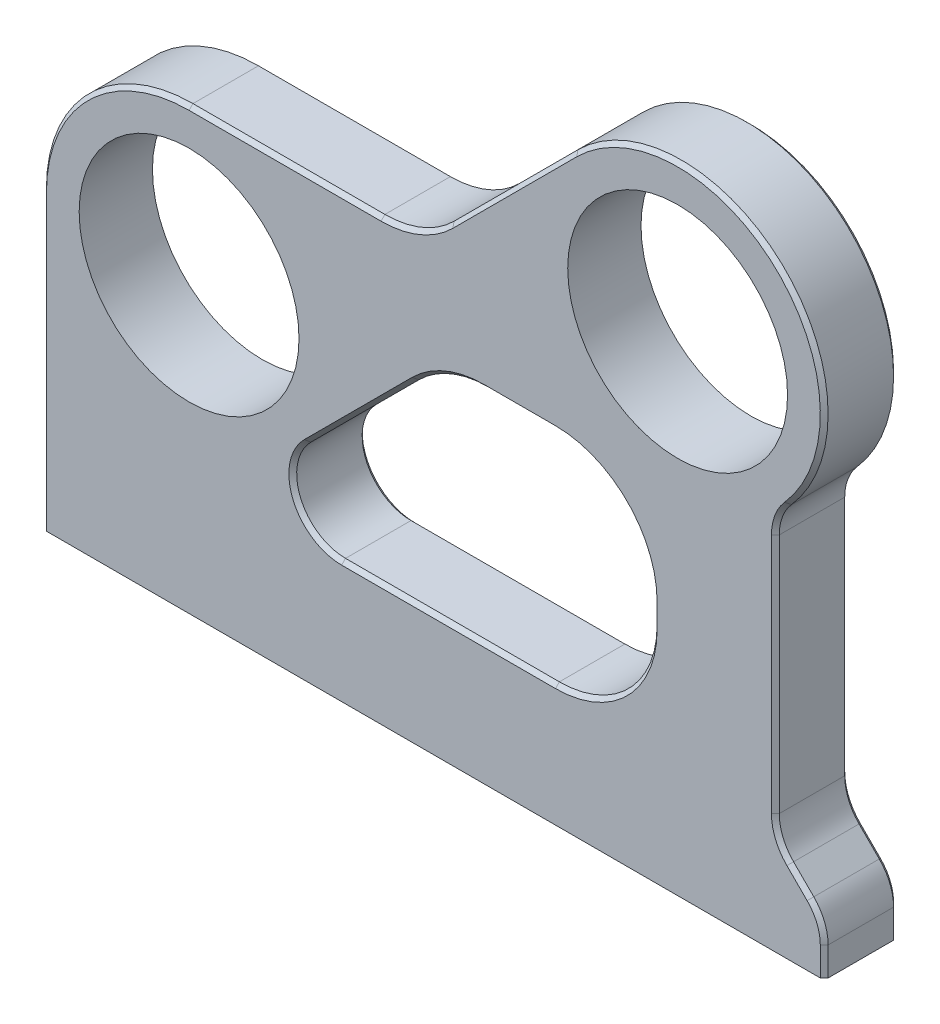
SolidWorks part; units mm, degrees
ref_plane "Front Plane" through (0, 0, 0) normal (0, 0, 1) x (1, 0, 0)
ref_plane "Top Plane" through (0, 0, 0) normal (0, 1, 0) x (1, 0, 0)
ref_plane "Right Plane" through (0, 0, 0) normal (1, 0, 0) x (0, 0, -1)
sketch "Sketch1" plane through (0, 0, 0) normal (0, 0, 1) x (1, 0, 0)
  line L0 (0, 19.05) -> (24.9487, 19.05)
  line L1 (29.3529, 2.6303) -> (15.3377, -11.3849)
  line L2 (-19.05, 0) -> (-19.05, -38.1)
  line L3 (-19.05, -38.1) -> (82.55, -38.1)
  line L5 (50.0296, 38.8704) -> (33.929, 22.7697)
  line L6 (47.625, 6.35) -> (38.3331, 6.35)
  line L7 (76.2, 8.5995) -> (76.2, -22.7697)
  line L8 (60.325, -6.35) -> (60.325, -9.525)
  line L10 (19.8279, -22.225) -> (47.625, -22.225)
  line L11 (78.0599, -27.2599) -> (80.6901, -29.8901)
  line L12 (82.55, -34.3803) -> (82.55, -38.1)
  circle A0 centre (0, 0) radius 14.2875
  arc A1 (77.7875, 12.7996) -> (50.0296, 38.8704) centre (63.5, 25.4) ccw
  circle A2 centre (63.5, 25.4) radius 14.2875
  arc A3 (0, 19.05) -> (-19.05, 0) centre (0, 0) ccw
  arc A4 (15.3377, -11.3849) -> (19.8279, -22.225) centre (19.8279, -15.875) ccw
  arc A5 (24.9487, 19.05) -> (33.929, 22.7697) centre (24.9487, 31.75) ccw
  arc A6 (38.3331, 6.35) -> (29.3529, 2.6303) centre (38.3331, -6.35) ccw
  arc A7 (47.625, 6.35) -> (60.325, -6.35) centre (47.625, -6.35) cw
  arc A8 (60.325, -9.525) -> (47.625, -22.225) centre (47.625, -9.525) cw
  arc A9 (76.2, 8.5995) -> (77.7875, 12.7996) centre (82.55, 8.5995) cw
  arc A10 (76.2, -22.7697) -> (78.0599, -27.2599) centre (82.55, -22.7697) ccw
  arc A11 (80.6901, -29.8901) -> (82.55, -34.3803) centre (76.2, -34.3803) cw
  point P34 (82.55, -31.75)
  dimension "D1" = 28.575
  dimension "D2" = 25.4
  dimension "D9" = 28.575
  dimension "D8" = 38.1
  dimension "D4" = 19.05
  dimension "D12" = 12.7
  dimension "D14" = 12.7
  dimension "D16" = 25.4
  dimension "D11" = 12.7
  dimension "D17" = 12.7
  dimension "D21" = 6.35
  dimension "D22" = 6.35
  dimension "D3" = 101.6
  dimension "D5" = 19.05
  dimension "D6" = 38.1
  dimension "D7" = 63.5
  dimension "D10" = 45
  dimension "D13" = 6.35
  dimension "D15" = 15.875
  dimension "D18" = 15.875
  dimension "D19" = 45
  dimension "D20" = 6.35
extrude "Extrude1" add sketch "Sketch1" along normal mid plane 9.525
hole_wizard "#8-32 Tapped Hole1" positions "Sketch3" profile "Sketch2" tap size "#8-32" standard "Ansi Inch"
sketch "Sketch3" plane through (0, -38.1, 0) normal (0, -1, 0) x (1, 0, 0)
  point P0 (63.5, 0)
  point P1 (-12.7, 0)
  dimension "D1" = 76.2
  dimension "D2" = 12.7
sketch "Sketch2" plane through (63.5, -38.1, 0) normal (1, 0, 0) x (0, 0, -1)
  line L0 (0, 0) -> (0, 21.2054)
  line L1 (0, 21.2054) -> (1.7272, 20.1676)
  line L2 (1.7272, 20.1676) -> (1.7272, 17.78)
  line L3 (1.7272, 17.78) -> (2.0828, 17.78)
  line L4 (2.0828, 17.78) -> (2.0828, 0)
  line L5 (2.0828, 0) -> (0, 0)
  line L10 (0, 21.2054) -> (-1.7272, 20.1676) construction
  line L11 (0, -6.35) -> (0, 107.95) construction
  dimension "Tap Drill Dia." = 3.4544
  dimension "Tap Drill Depth" = 20.1676
  dimension "Thread Major Dia." = 4.1656
  dimension "Thread Depth" = 17.78
  dimension "Drill Angle" = 118
sketch "Sketch4" plane through (0, -38.1, 0) normal (0, -1, 0) x (1, 0, 0)
  circle A0 centre (0, 0) radius 2.3813
  circle A1 centre (50.8, 0) radius 2.3812
  circle A2 centre (-12.7, 0) radius 2.0828 construction
  circle A3 centre (63.5, 0) radius 2.0828 construction
  dimension "D1" = 4.7625
  dimension "D2" = 12.7
  dimension "D3" = 12.7
extrude "Cut-Extrude1" cut sketch "Sketch4" against normal blind 12.7
chamfer "Chamfer1" distance 0.508 angle 45 24 edges at (82.55, -36.2401, -4.7625) (82.0666, -31.9502, -4.7625) (79.375, -28.575, -4.7625) (76.6834, -25.1998, -4.7625) (76.2, -7.0851, -4.7625) (76.6101, 10.8445, -4.7625) (76.5418, 39.2858, -4.7625) (41.9793, 30.8201, -4.7625) (29.8088, 20.0167, -4.7625) (12.4744, 19.05, -4.7625) (-13.4704, 13.4704, -4.7625) (-19.05, -19.05, -4.7625) (82.55, -36.2401, 4.7625) (82.0666, -31.9502, 4.7625) (79.375, -28.575, 4.7625) (76.6834, -25.1998, 4.7625) (76.2, -7.0851, 4.7625) (76.6101, 10.8445, 4.7625) (76.5418, 39.2858, 4.7625) (41.9793, 30.8201, 4.7625) (29.8088, 20.0167, 4.7625) (12.4744, 19.05, 4.7625) (-13.4704, 13.4704, 4.7625) (-19.05, -19.05, 4.7625)
chamfer "Chamfer2" distance 0.508 angle 45 16 edges at (33.7264, -22.225, 4.7625) (56.6053, -18.5053, 4.7625) (60.325, -7.9375, 4.7625) (56.6053, 2.6303, 4.7625) (42.9791, 6.35, 4.7625) (33.473, 5.3833, 4.7625) (22.3453, -4.3773, 4.7625) (13.9612, -18.305, 4.7625) (60.325, -7.9375, -4.7625) (56.6053, 2.6303, -4.7625) (42.9791, 6.35, -4.7625) (33.473, 5.3833, -4.7625) (22.3453, -4.3773, -4.7625) (13.9612, -18.305, -4.7625) (56.6053, -18.5053, -4.7625) (33.7264, -22.225, -4.7625)
